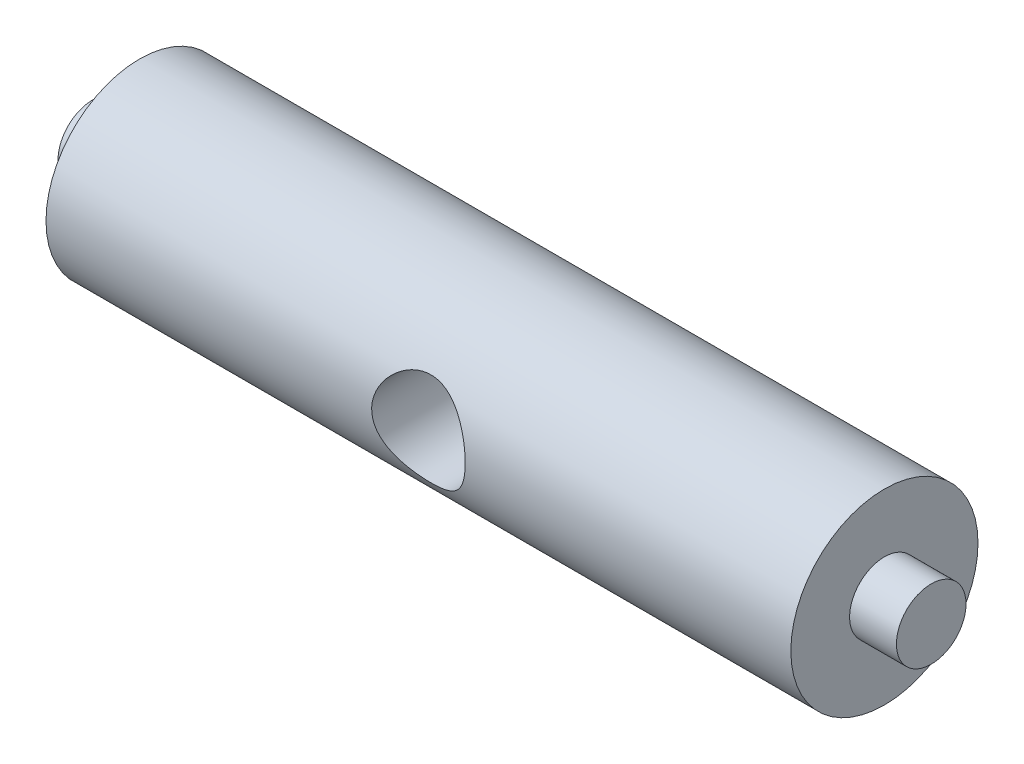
SolidWorks part; units mm, degrees
ref_plane "Plane1" through (0, 0, 0) normal (0, 0, 1) x (1, 0, 0)
ref_plane "Plane2" through (0, 0, 0) normal (0, 1, 0) x (1, 0, 0)
ref_plane "Plane3" through (0, 0, 0) normal (1, 0, 0) x (0, 0, -1)
sketch "Sketch6" plane through (0, 0, 0) normal (0, 0, 1) x (1, 0, 0)
  line L0 (82.5512, 0) -> (-82.5664, 0) construction
  line L1 (-28.448, 0) -> (-28.448, -2.3622)
  line L2 (-28.448, -2.3622) -> (-25.273, -2.3622)
  line L3 (-25.273, -2.3622) -> (-25.273, -6.35)
  line L4 (-25.273, -6.35) -> (25.273, -6.35)
  line L5 (25.273, -6.35) -> (25.273, -2.3622)
  line L6 (25.273, -2.3622) -> (28.448, -2.3622)
  line L7 (28.448, -2.3622) -> (28.448, 0)
  line L8 (-28.448, 0) -> (28.448, 0)
  dimension "D1" = 2.3622
  dimension "D2" = 2.3622
  dimension "D3" = 6.35
  dimension "D4" = 25.273
  dimension "D5" = 3.175
  dimension "D6" = 3.175
  dimension "D7" = 50.546
revolve "Base-Revolve" add sketch "Sketch6" angle 360 about L0
ref_plane "Plane5" through (0, 0, 6.35) normal (0, 0, 1) x (1, 0, 0)
sketch "Sketch9" plane through (0, 0, 6.35) normal (0, 0, 1) x (1, 0, 0)
  circle A0 centre (0, 0) radius 3.175
  dimension "D1" = 6.35
extrude "Cut-Extrude1" cut sketch "Sketch9" against normal through all
